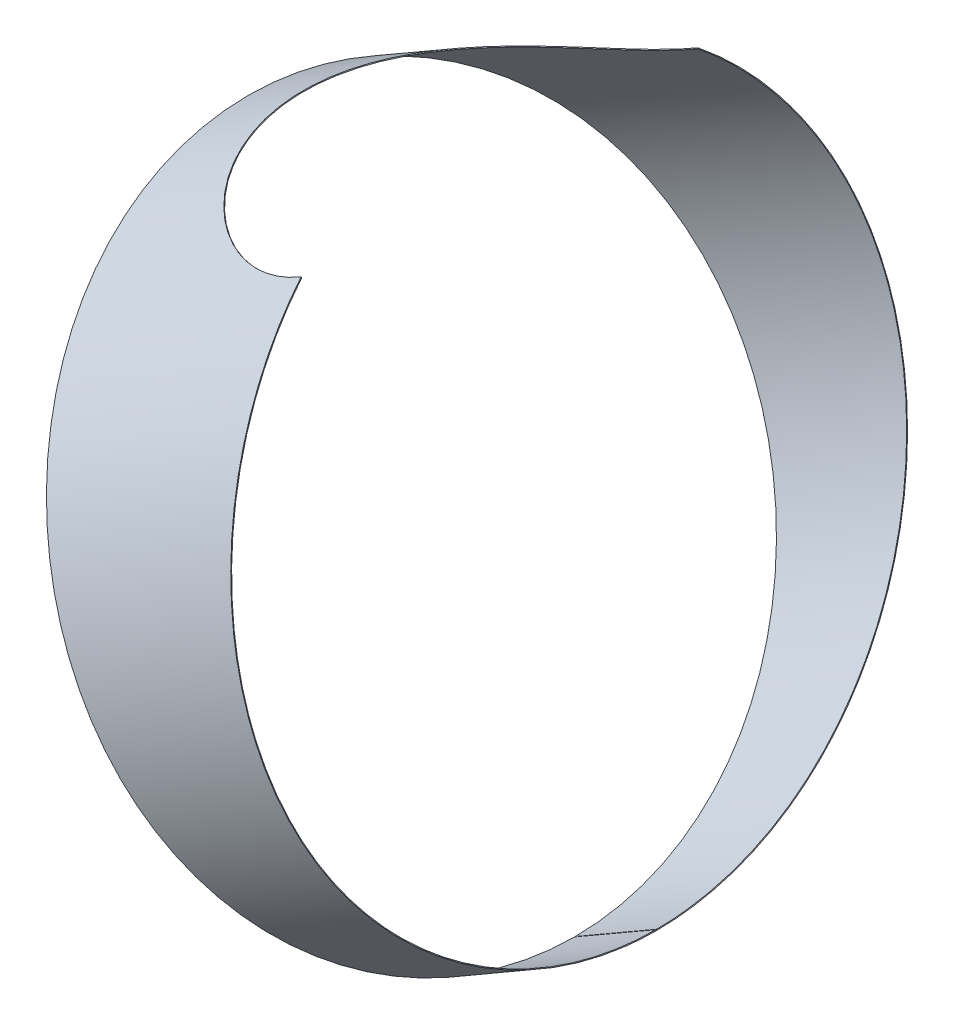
SolidWorks part; units mm, degrees
ref_plane "前视基准面" through (0, 0, 0) normal (0, 0, 1) x (1, 0, 0)
ref_plane "上视基准面" through (0, 0, 0) normal (0, 1, 0) x (1, 0, 0)
ref_plane "右视基准面" through (0, 0, 0) normal (1, 0, 0) x (0, 0, -1)
imported_body "基体零件-弯头节对接缝上平接分支管管-1"
sheet metal parameters "钣金1" parameters "D1"=0.7366, "厚度"=1
bend "圆角折弯1" bend radius 409 bend angle 359.86 parameters "D5"=1
flatten bends "展开-折弯1" parameters "D1"=0
sketch "尖角-草图1" plane through (-168.9489, 410.5259, 0.5) normal (0.5, -0.866, 0.0012) x (0.866, 0.5, -0.0007)
  line L0 (-59.8532, 1284.3708) -> (58.0445, 1284.4538) construction
process bends "加工-折弯1" parameters "D1"=0
sketch "平面-草图1" plane through (-168.9489, 410.5259, 0.5) normal (0.5, -0.866, 0.0012) x (0.866, 0.5, -0.0007)
